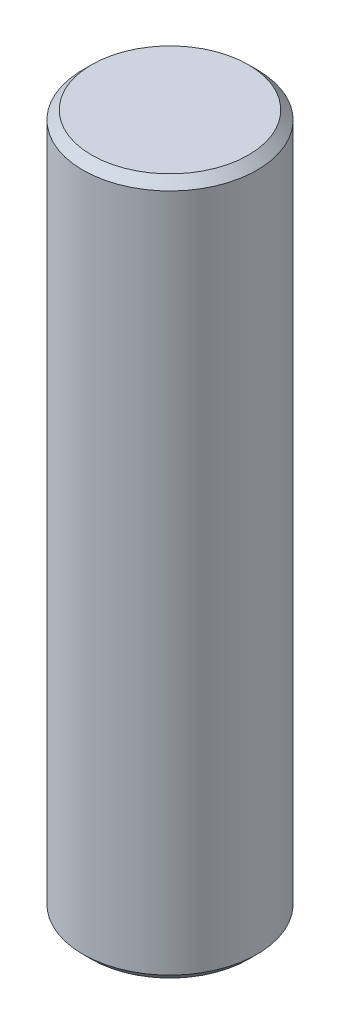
SolidWorks part; units mm, degrees
ref_plane "Front Plane" through (0, 0, 0) normal (0, 0, 1) x (1, 0, 0)
ref_plane "Top Plane" through (0, 0, 0) normal (0, 1, 0) x (1, 0, 0)
ref_plane "Right Plane" through (0, 0, 0) normal (1, 0, 0) x (0, 0, -1)
sketch "Sketch1" plane through (0, 0, 0) normal (0, 1, 0) x (1, 0, 0)
  circle A0 centre (0, 0) radius 1
  dimension "D1" = 2
extrude "Boss-Extrude1" add sketch "Sketch1" along normal blind 8
chamfer "Chamfer1" distance 0.1 angle 45 2 edges at (0, 0, 1) (0, 8, 1)
